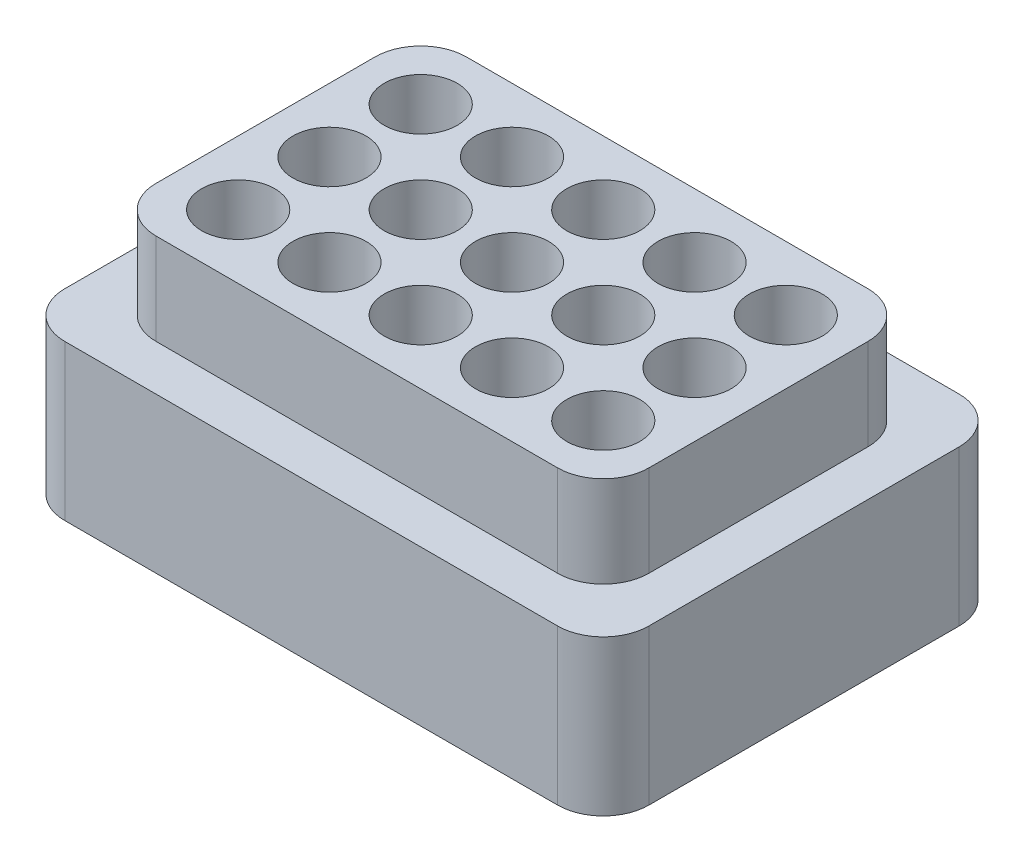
SolidWorks part; units mm, degrees
ref_plane "Front" through (0, 0, 0) normal (0, 0, 1) x (1, 0, 0)
ref_plane "Top" through (0, 0, 0) normal (0, 1, 0) x (1, 0, 0)
ref_plane "Right" through (0, 0, 0) normal (1, 0, 0) x (0, 0, -1)
sketch "Эскиз2" plane through (0, 0, 0) normal (0, 1, 0) x (1, 0, 0)
  line L1 (-28.8144, 20.7321) -> (35.1856, 20.7321)
  line L2 (-28.8144, 20.7321) -> (-28.8144, -23.2679)
  line L3 (-28.8144, -23.2679) -> (35.1856, -23.2679)
  line L4 (35.1856, 20.7321) -> (35.1856, -23.2679)
  line L5 (-28.8144, 20.7321) -> (35.1856, -23.2679) construction
  line L6 (-28.8144, -23.2679) -> (35.1856, 20.7321) construction
  circle A0 centre (-16.8144, 8.7321) radius 4
  circle A1 centre (-6.8144, 8.7321) radius 4
  circle A2 centre (3.1856, 8.7321) radius 4
  circle A3 centre (13.1856, 8.7321) radius 4
  circle A4 centre (23.1856, 8.7321) radius 4
  circle A5 centre (-6.8144, -1.2679) radius 4
  circle A6 centre (3.1856, -1.2679) radius 4
  circle A7 centre (13.1856, -1.2679) radius 4
  circle A8 centre (23.1856, -1.2679) radius 4
  circle A9 centre (-6.8144, -11.2679) radius 4
  circle A10 centre (3.1856, -11.2679) radius 4
  circle A11 centre (13.1856, -11.2679) radius 4
  circle A12 centre (23.1856, -11.2679) radius 4
  circle A13 centre (-16.8144, -1.2679) radius 4
  circle A14 centre (-16.8144, -11.2679) radius 4
  dimension "D1" = 8
  dimension "D4" = 12
  dimension "D5" = 12
  dimension "D2" = 5
  dimension "D3" = 3
extrude "Бобышка-Вытянуть1" add sketch "Эскиз2" along normal blind 25
sketch "Эскиз4" plane through (0, 0, 0) normal (0, -1, 0) x (1, 0, 0)
  line L0 (35.1856, 23.2679) -> (35.1856, -20.7321) construction
  line L1 (35.1856, -20.7321) -> (-28.8144, -20.7321) construction
  line L2 (-28.8144, -20.7321) -> (-28.8144, 23.2679) construction
  line L3 (-28.8144, 23.2679) -> (35.1856, 23.2679) construction
  line L4 (35.1856, 23.2679) -> (35.1856, -20.7321)
  line L5 (35.1856, -20.7321) -> (-28.8144, -20.7321)
  line L6 (-28.8144, -20.7321) -> (-28.8144, 23.2679)
  line L7 (-28.8144, 23.2679) -> (35.1856, 23.2679)
extrude "Бобышка-Вытянуть2" add sketch "Эскиз4" along normal blind 2
sketch "Эскиз5" plane through (0, 25, 0) normal (0, 1, 0) x (1, 0, 0)
  line L0 (-28.8144, -23.2679) -> (35.1856, -23.2679) construction
  line L1 (35.1856, -23.2679) -> (35.1856, 20.7321) construction
  line L2 (35.1856, 20.7321) -> (-28.8144, 20.7321) construction
  line L3 (-28.8144, 20.7321) -> (-28.8144, -23.2679) construction
  line L4 (-28.8144, -23.2679) -> (35.1856, -23.2679)
  line L5 (35.1856, -23.2679) -> (35.1856, 20.7321)
  line L6 (35.1856, 20.7321) -> (-28.8144, 20.7321)
  line L7 (-28.8144, 20.7321) -> (-28.8144, -23.2679)
  line L8 (-23.8144, -18.2679) -> (30.1856, -18.2679)
  line L9 (30.1856, -18.2679) -> (30.1856, 15.7321)
  line L10 (30.1856, 15.7321) -> (-23.8144, 15.7321)
  line L11 (-23.8144, 15.7321) -> (-23.8144, -18.2679)
  dimension "D1" = 5
extrude "Вырез-Вытянуть1" cut sketch "Эскиз5" against normal blind 10
fillet "Скругление1" radius 5 8 edges at (-28.8144, 6.5, -20.7321) (-23.8144, 20, -15.7321) (30.1856, 20, -15.7321) (-23.8144, 20, 18.2679) (-28.8144, 6.5, 23.2679) (35.1856, 6.5, -20.7321) (35.1856, 6.5, 23.2679) (30.1856, 20, 18.2679)
